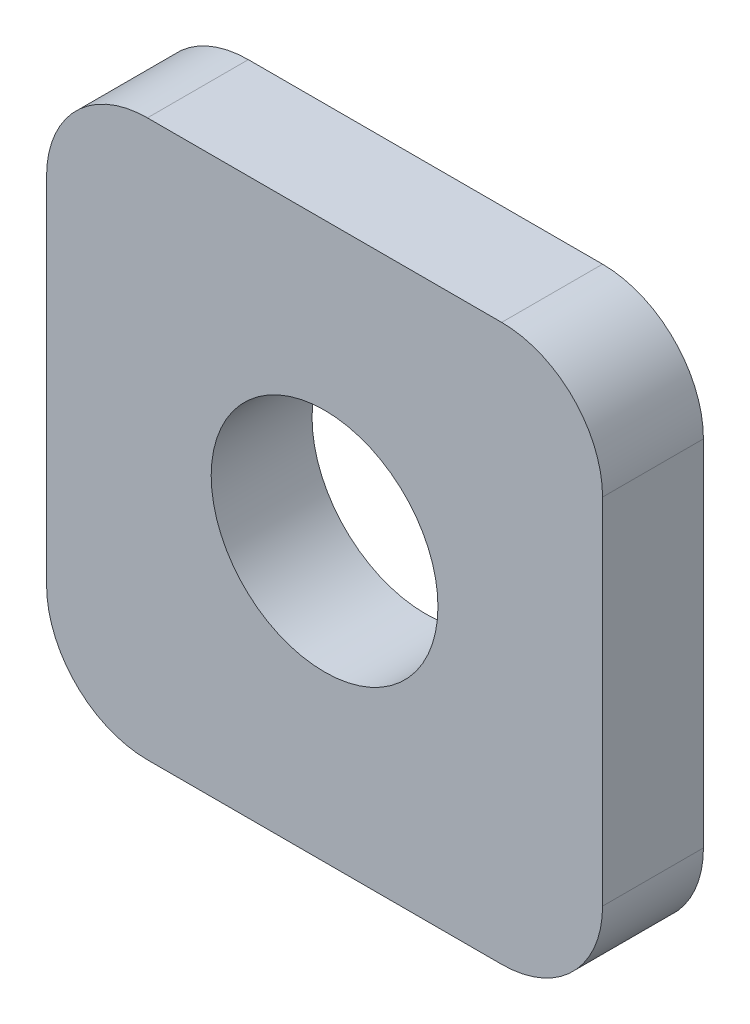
SolidWorks part; units mm, degrees
ref_plane "Front Plane" through (0, 0, 0) normal (1, 0, 0) x (0, 1, 0)
ref_plane "Top Plane" through (0, 0, 0) normal (0, 0, 1) x (0, 1, 0)
ref_plane "Right Plane" through (0, 0, 0) normal (0, 1, 0) x (-1, 0, 0)
sketch "Sketch1" plane through (0, 0, 0) normal (0, 0, 1) x (0, 1, 0)
  line L1 (-11.15, 17.5) -> (11.15, 17.5)
  line L2 (-17.5, 11.15) -> (-17.5, -11.15)
  line L3 (-11.15, -17.5) -> (11.15, -17.5)
  line L4 (17.5, 11.15) -> (17.5, -11.15)
  line L5 (-17.5, 17.5) -> (17.5, -17.5) construction
  line L6 (-17.5, -17.5) -> (17.5, 17.5) construction
  circle A0 centre (0, 0) radius 7.1374
  arc A1 (-17.5, -11.15) -> (-11.15, -17.5) centre (-11.15, -11.15) ccw
  arc A2 (11.15, -17.5) -> (17.5, -11.15) centre (11.15, -11.15) ccw
  arc A3 (11.15, 17.5) -> (17.5, 11.15) centre (11.15, 11.15) cw
  arc A4 (-11.15, 17.5) -> (-17.5, 11.15) centre (-11.15, 11.15) ccw
  dimension "D1" = 14.2748
  dimension "D2" = 35
  dimension "D4" = 6.35
  dimension "D3" = 35
extrude "Boss-Extrude1" add sketch "Sketch1" along normal mid plane 6.35
